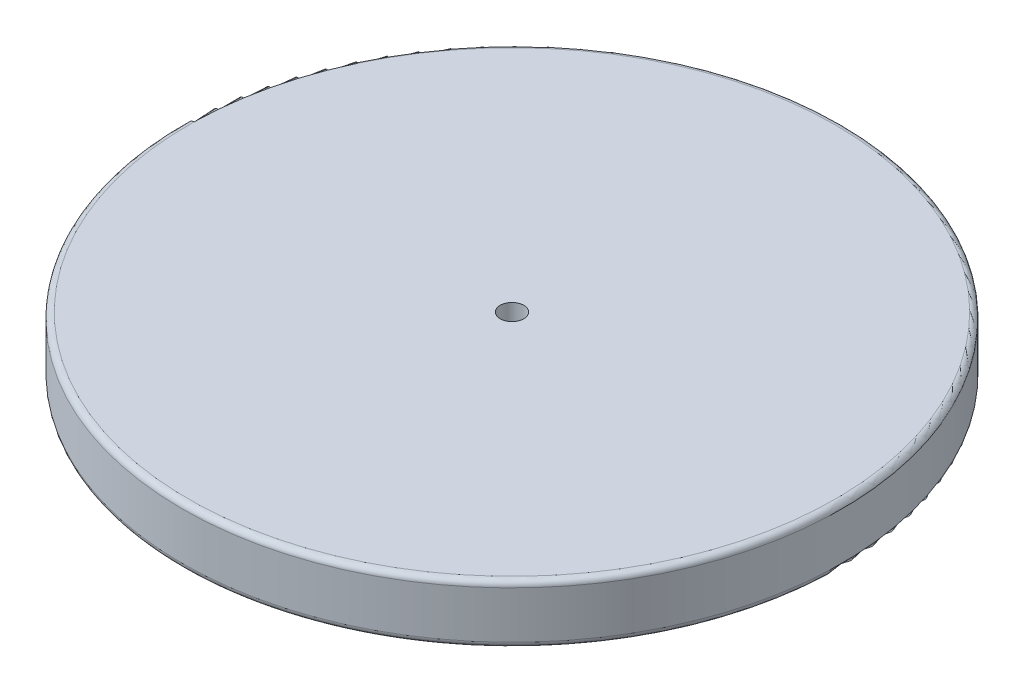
SolidWorks part; units mm, degrees
ref_plane "Plan de face" through (0, 0, 0) normal (0, 0, 1) x (1, 0, 0)
ref_plane "Plan de dessus" through (0, 0, 0) normal (0, 1, 0) x (1, 0, 0)
ref_plane "Plan de coté" through (0, 0, 0) normal (1, 0, 0) x (0, 0, -1)
sketch "Esquisse1" plane through (0, 0, 0) normal (0, 0, 1) x (1, 0, 0)
  line L0 (0, 0) -> (0, 27.5025) construction
  line L1 (5, 12.5) -> (137.5, 12.5)
  line L2 (5, 12.5) -> (5, -12.5)
  line L3 (5, -12.5) -> (137.5, -12.5)
  line L4 (140, 10) -> (140, -10)
  arc A0 (137.5, -12.5) -> (140, -10) centre (137.5, -10) ccw
  arc A1 (137.5, 12.5) -> (140, 10) centre (137.5, 10) cw
  point P7 (5, 0)
  dimension "D3" = 2.5
  dimension "D1" = 280
  dimension "D2" = 25
  dimension "D4" = 10
revolve "Révolution1" add sketch "Esquisse1" angle 360 about L0
